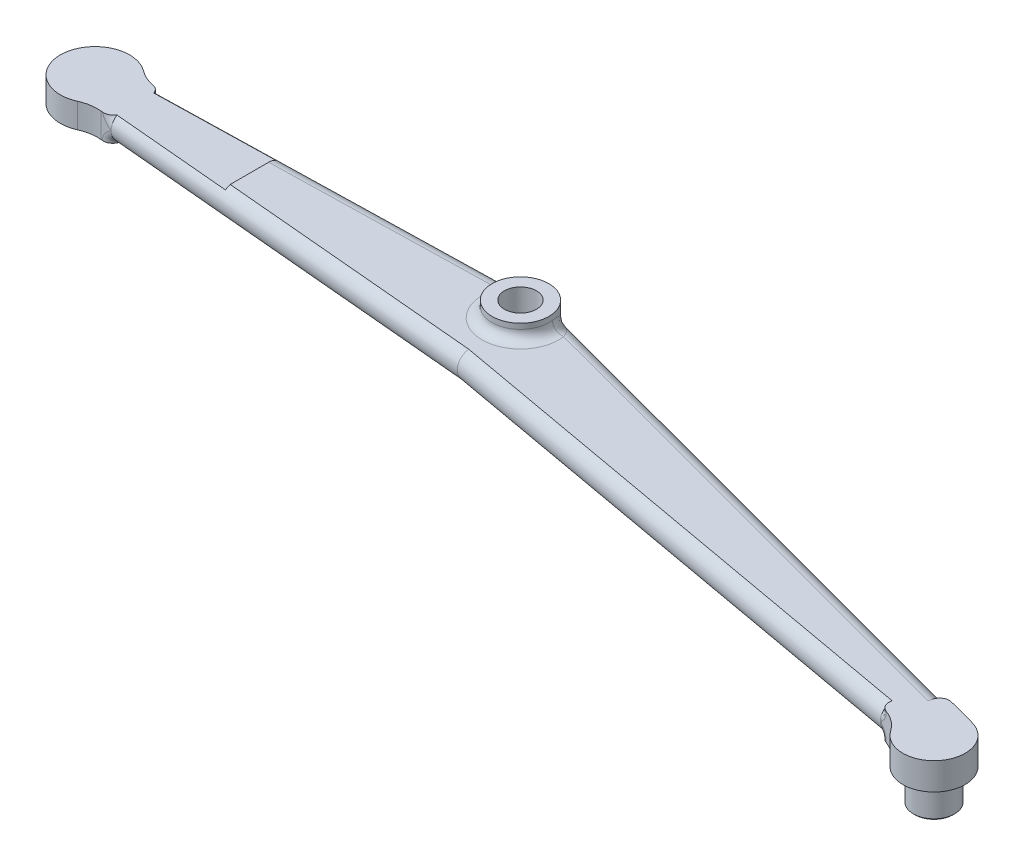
SolidWorks part; units mm, degrees
ref_plane "Спереди" through (0, 0, 0) normal (0, 0, 1) x (1, 0, 0)
ref_plane "Сверху" through (0, 0, 0) normal (0, 1, 0) x (1, 0, 0)
ref_plane "Справа" through (0, 0, 0) normal (1, 0, 0) x (0, 0, -1)
sketch "Эскиз1" plane through (0, 0, 0) normal (0, 1, 0) x (1, 0, 0)
  line L0 (-60.386, 3.1114) -> (-0.1056, 4.52)
  line L1 (1.1684, 4.3676) -> (91.7097, -19.8532)
  line L2 (-62.2678, -4.4964) -> (0, -10.0584)
  line L3 (0, -10.0584) -> (82.2773, -24.847)
  line L4 (-123.1998, 0) -> (73.2337, 0) construction
  circle A0 centre (0, 0) radius 2.5527
  arc A1 (-64.3655, 4.3956) -> (-65.4335, -5.0283) centre (-67.691, 0) ccw
  arc A2 (91.7097, -19.8532) -> (86.365, -27.4683) centre (90.4297, -24.638) cw
  arc A3 (-0.1056, 4.52) -> (1.1684, 4.3676) centre (0, 0) cw
  arc A4 (86.365, -27.4683) -> (82.2773, -24.847) centre (81.1539, -31.0969) ccw
  arc A5 (-60.386, 3.1114) -> (-64.3655, 4.3956) centre (-60.5344, 9.4597) cw
  arc A6 (-65.4335, -5.0283) -> (-62.2678, -4.4964) centre (-62.8327, -10.8213) cw
  point P16 (85.541, -25.4337)
  point P19 (-63.0987, 3.048)
  point P22 (-64.2654, -4.318)
  dimension "D1" = 5.5118
  dimension "D2" = 4.953
  dimension "D8" = 4.5212
  dimension "D11" = 5.1054
  dimension "D12" = 6.35
  dimension "D3" = 67.691
  dimension "D4" = 3.048
  dimension "D5" = 4.318
  dimension "D6" = 24.638
  dimension "D7" = 93.726
  dimension "D9" = 10.0584
  dimension "D10" = 6.985
extrude "Бобышка-Вытянуть1" add sketch "Эскиз1" along normal blind 4.318
sketch "Эскиз2" plane through (0, 4.318, 0) normal (0, 1, 0) x (1, 0, 0)
  line L0 (-62.2678, -4.4964) -> (0, -10.0584) construction
  line L1 (-41.4528, 5.5118) -> (-73.2028, 5.5118)
  line L2 (-41.4528, 5.5118) -> (-41.4528, -6.3557)
  line L3 (-41.4528, -6.3557) -> (-73.2028, -6.3557)
  line L4 (-73.2028, 5.5118) -> (-73.2028, -6.3557)
  arc A0 (-64.3655, 4.3956) -> (-65.4335, -5.0283) centre (-67.691, 0) ccw construction
  dimension "D1" = 31.75
extrude "Вырез-Вытянуть1" cut sketch "Эскиз2" against normal offset from surface (0.381 mm away) 3.937
sketch "Эскиз3" plane through (0, 0, 0) normal (0, -1, 0) x (1, 0, 0)
  circle A0 centre (90.4297, 24.638) radius 3.2766
  arc A1 (91.7097, 19.8532) -> (86.365, 27.4683) centre (90.4297, 24.638) ccw construction
  dimension "D1" = 6.5532
extrude "Бобышка-Вытянуть2" add sketch "Эскиз3" along normal blind 5.1308
fillet "Скругление1" radius 0.7937 1 edges at (90.4297, 0, 27.9146)
chamfer "Фаска1" distance 0.254 angle 45 1 edges at (90.4297, -5.1308, 21.3614)
sketch "Эскиз6" plane through (0, 0, 0) normal (0, -1, 0) x (-1, 0, 0)
  line L0 (-82.0685, -24.8095) -> (0, -10.0584)
  line L1 (0, -10.0584) -> (-82.2773, -24.847) construction
  line L2 (0, -10.0584) -> (60.4677, -4.6572)
  line L3 (62.2678, -4.4964) -> (0, -10.0584) construction
  arc A0 (-91.7097, -19.8532) -> (-86.365, -27.4683) centre (-90.4297, -24.638) ccw construction
  arc A1 (65.4335, -5.0283) -> (64.3655, 4.3956) centre (67.691, 0) ccw construction
  point P5 (-94.4838, -27.4834)
  point P12 (73.1677, 0.6207)
  dimension "D1" = 12.7
  dimension "D2" = 12.7
ref_plane "Плоскость1" through (82.0685, 0, 24.8095) normal (-0.9842, 0, -0.1769) x (-0.1769, 0, 0.9842)
sketch "Эскиз7" plane through (82.0685, 0, 24.8095) normal (-0.9842, 0, -0.1769) x (-0.1769, 0, 0.9842)
  line L0 (-1.622, 0) -> (2.0701, 0)
  line L1 (2.0701, 0) -> (2.0701, 4.318)
  line L2 (2.0701, 4.318) -> (-1.622, 4.318)
  line L3 (-6.5837, 0) -> (3.305, 0) construction
  line L4 (3.305, 4.318) -> (-6.5837, 4.318) construction
  arc A0 (-1.622, 0) -> (-1.622, 4.318) centre (-2.2479, 2.159) ccw
  point P9 (0, 0)
  point P10 (0, 2.159)
  dimension "D1" = 2.2479
  dimension "D2" = 4.318
sweep "Вырез-По траектории1" cut profiles "Эскиз7" path "Эскиз6"
sketch "Эскиз8" plane through (0, 0, 0) normal (0, -1, 0) x (1, 0, 0)
  line L0 (-60.4677, -3.1095) -> (-0.1056, -4.52)
  line L1 (85.7536, 18.2599) -> (1.1684, -4.3676)
  line L2 (91.7097, 19.8532) -> (1.1684, -4.3676) construction
  line L3 (-0.1056, -4.52) -> (-60.386, -3.1114) construction
  arc A0 (-0.1056, -4.52) -> (1.1684, -4.3676) centre (0, 0) ccw
  arc A1 (-0.1056, -4.52) -> (1.1684, -4.3676) centre (0, 0) ccw construction
  arc A2 (-65.4335, 5.0283) -> (-64.3655, -4.3956) centre (-67.691, 0) ccw construction
  arc A3 (91.7097, 19.8532) -> (86.365, 27.4683) centre (90.4297, 24.638) ccw construction
  point P12 (-73.1677, -0.6207)
  point P21 (94.4838, 27.4834)
  dimension "D1" = 12.7
  dimension "D2" = 12.7
ref_plane "Плоскость2" through (-60.4677, 0, -3.1095) normal (0.9997, 0, -0.0234) x (-0.0234, 0, -0.9997)
sketch "Эскиз9" plane through (-60.4677, 0, -3.1095) normal (0.9997, 0, -0.0234) x (-0.0234, 0, -0.9997)
  line L0 (-2.159, 0) -> (4.2653, 0)
  line L1 (4.2653, 0) -> (4.2653, 4.318)
  line L2 (4.2653, 4.318) -> (-2.159, 4.318)
  line L3 (-8.4517, 0) -> (2.5719, 0) construction
  line L7 (-8.2788, 4.318) -> (0, 4.318) construction
  arc A0 (-2.159, 4.318) -> (-2.159, 0) centre (-2.159, 2.159) cw
  point P9 (0, 2.159)
  point P10 (0, 0)
  dimension "D1" = 2.159
sweep "Вырез-По траектории2" cut profiles "Эскиз9" path "Эскиз8"
sketch "Эскиз5" plane through (0, 0, 0) normal (0, 0, 1) x (1, 0, 0)
  line L0 (0, -10.2601) -> (0, 10.9087) construction
  line L2 (2.5527, 4.318) -> (2.5527, 6.7564)
  line L3 (2.5527, 6.7564) -> (4.5212, 6.7564)
  line L5 (2.5527, 4.318) -> (2.5527, -1.1176)
  line L6 (2.5527, -1.1176) -> (4.5212, -1.1176)
  line L7 (2.5527, 0) -> (2.5527, 4.318) construction
  line L8 (-62.2678, 0) -> (-60.4677, 0) construction
  line L9 (4.5212, 6.7564) -> (4.5212, 4.318)
  line L10 (4.5212, 4.318) -> (4.5212, -1.1176)
  dimension "D2" = 7.874
  dimension "D3" = 6.7564
  dimension "D4" = 9.0424
revolve "Повернуть1" add sketch "Эскиз5" angle 360 about L0
fillet "Скругление3" radius 1.524 7 edges at (82.0685, 1.0795, 24.8095) (82.0685, 3.2385, 24.8095) (85.7536, 1.0795, 18.2599) (85.7536, 3.2385, 18.2599) (-60.4677, 3.048, 4.6572) (-60.4677, 1.0795, 4.6572) (-60.4678, 1.9685, -3.11)
fillet "Скругление5" radius 1.5875 5 edges at (-2.9774, 4.0115, -3.4024) (3.6957, 4.0115, -2.6045) (-4.4726, 3.6118, -0.6608) (4.5024, 3.6118, 0.4124) (-0.5368, 4.318, 4.4892)
